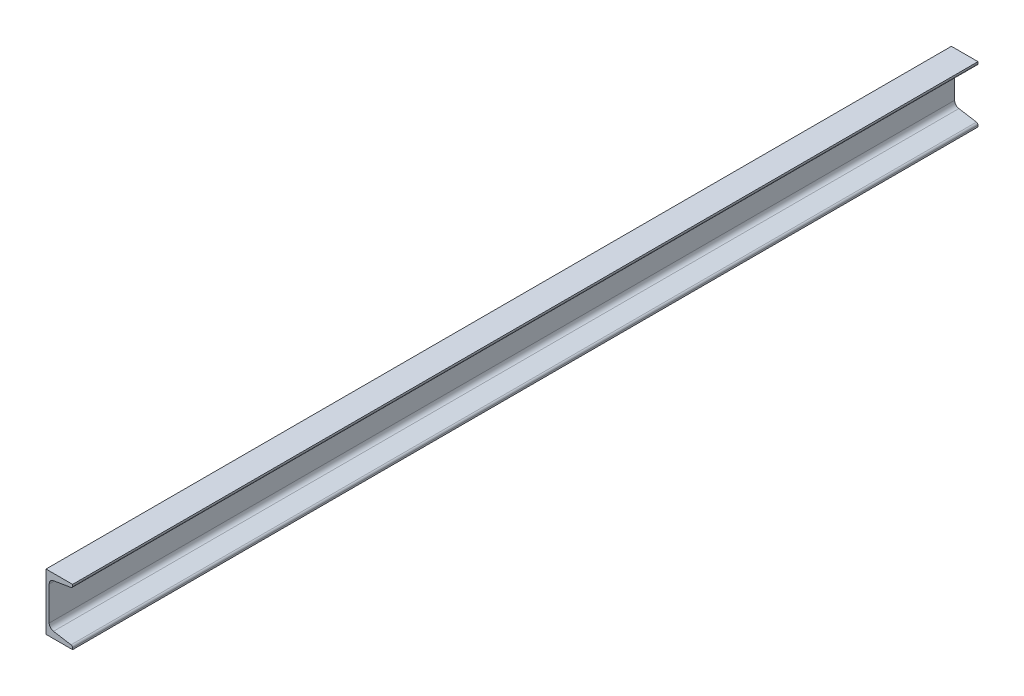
SolidWorks part; units mm, degrees
ref_plane "FRONT" through (0, 0, 0) normal (0, 0, 1) x (1, 0, 0)
ref_plane "TOP" through (0, 0, 0) normal (0, 1, 0) x (-1, 0, 0)
ref_plane "RIGHT" through (0, 0, 0) normal (1, 0, 0) x (0, 0, -1)
sketch "Sketch1" plane through (0, 0, 0) normal (0, 0, 1) x (1, 0, 0)
  line L0 (0, 0) -> (0, 76.2)
  line L1 (0, 76.2) -> (35.814, 76.2)
  line L2 (0, 0) -> (35.814, 0)
  line L3 (19.6977, 0) -> (-19.6977, 0) construction
  line L4 (0, -41.91) -> (0, 41.91) construction
  line L12 (4.318, 60.8314) -> (4.318, 15.3686)
  line L15 (35.814, 76.2) -> (35.814, 74.0423)
  line L16 (35.814, 0) -> (35.814, 2.1577)
  line L17 (10.0485, 67.5961) -> (33.6916, 71.5369)
  line L18 (10.0485, 8.6039) -> (33.6916, 4.6631)
  arc A9 (4.318, 15.3686) -> (10.0485, 8.6039) centre (11.176, 15.3686) ccw
  arc A10 (4.318, 60.8314) -> (10.0485, 67.5961) centre (11.176, 60.8314) cw
  arc A11 (35.814, 74.0423) -> (33.6916, 71.5369) centre (33.274, 74.0423) cw
  arc A12 (35.814, 2.1577) -> (33.6916, 4.6631) centre (33.274, 2.1577) ccw
  dimension "RI" = 6.858
  dimension "D2" = 9.463
  dimension "RA" = 2.54
  dimension "Depth" = 76.2
  dimension "BF" = 35.814
  dimension "TW" = 4.318
  dimension "flange" = 2.1577
extrude "BaseChannel" add sketch "Sketch1" along normal mid plane 1219.2
